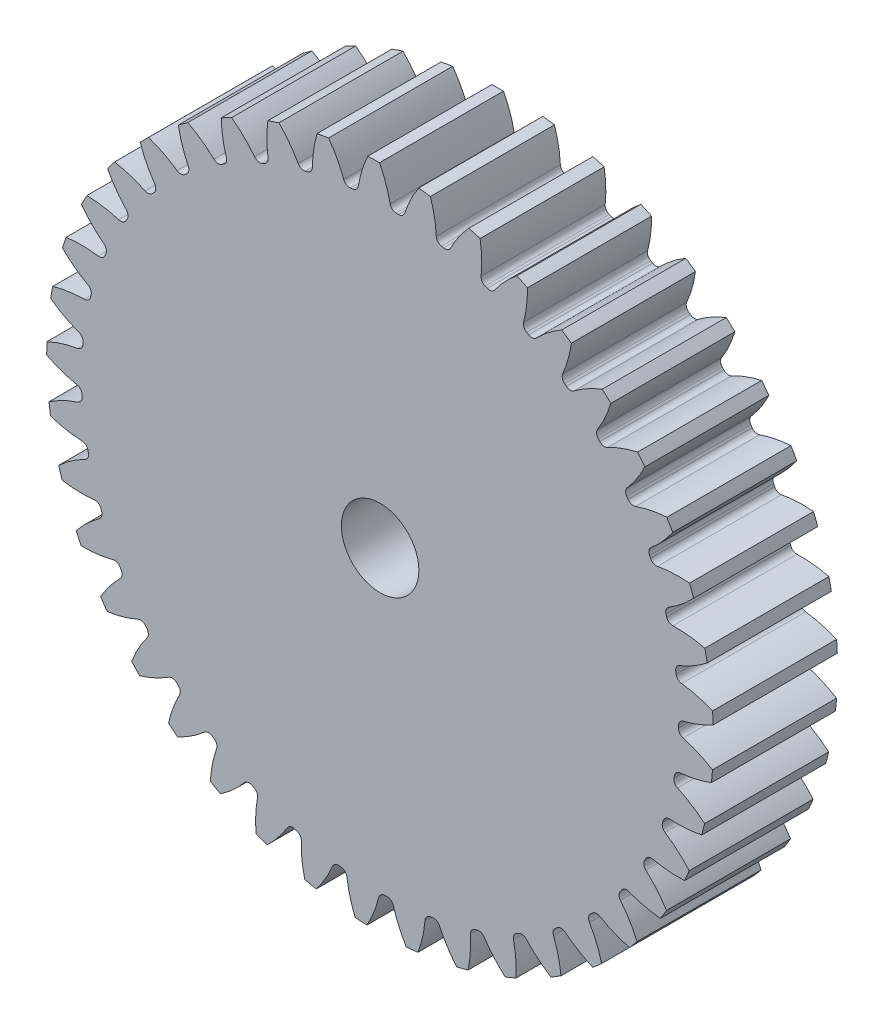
SolidWorks part; units mm, degrees
ref_plane "Front" through (0, 0, 0) normal (0, 0, 1) x (1, 0, 0)
ref_plane "Top" through (0, 0, 0) normal (0, 1, 0) x (1, 0, 0)
ref_plane "Right" through (0, 0, 0) normal (1, 0, 0) x (0, 0, -1)
sketch "Sketch3" plane through (0, 0, 0) normal (0, 0, 1) x (1, 0, 0)
  circle A0 centre (0, 0) radius 273.05
  dimension "od" = 546.1
extrude "gearBody" add sketch "Sketch3" along normal blind 101.6
sketch "Sketch2" plane through (0, 0, 0) normal (0, 0, 1) x (1, 0, 0)
  line L0 (0, 0) -> (226.0262, 93.6231) construction
  line L1 (272.4391, -21.3623) -> (0, 0) construction
  line L2 (0, 0) -> (36.3143, 0) construction
  line L3 (260.3013, 5.0374) -> (259.9273, -14.8297) construction
  line L5 (260.1143, -4.8962) -> (0, 0) construction
  line L7 (0, 0) -> (244.649, 0) construction
  arc A0 (244.6485, 0.4812) -> (244.4571, -9.6877) centre (0, 0) ccw construction
  arc A1 (272.8296, 10.9693) -> (272.2235, -21.2289) centre (0, 0) ccw construction
  arc A2 (260.3013, 5.0374) -> (259.9273, -14.8297) centre (0, 0) ccw construction
  arc A3 (244.4116, -5.5655) -> (244.448, -3.6364) centre (0, 0) ccw
  arc A4 (272.4391, -21.3623) -> (248.1735, -10.6573) centre (222.3428, -102.0628) ccw
  arc A5 (272.4391, -21.3623) -> (273.05, 11.0945) centre (0, 0) ccw
  arc A6 (273.05, 11.0945) -> (248.3988, 1.3102) centre (226.0262, 93.6231) cw
  arc A7 (244.448, -3.6364) -> (248.3988, 1.3102) centre (249.6163, -3.7133) cw
  arc A8 (248.1735, -10.6573) -> (244.4116, -5.5655) centre (249.5792, -5.6832) cw
  point P6 (273.05, 11.0945)
  point P22 (272.4391, -21.3623)
  dimension "baseDia" = 489.2979
  dimension "od" = 546.1
  dimension "pd" = 520.7
  dimension "rd" = 488.95
  dimension "rFillet" = 5.1689
  dimension "pointX" = 273.05
  dimension "pointY" = 11.0945
  dimension "CTT" = 19.8672
  dimension "flankCenterAngle" = 22.5
extrude "toothCut" cut sketch "Sketch2" along normal through all
pattern_circular "CirPattern1" count 41 over 360 about axis through (0, 0, 0) along (0, 0, 1) of "toothCut"
sketch "hub1Dia" plane through (0, 0, 0) normal (0, 0, -1) x (-1, 0, 0)
  circle A0 centre (0, 0) radius 12.7
  dimension "hub1Dia" = 25.4
sketch "hub2Dia" plane through (0, 0, 101.6) normal (0, 0, 1) x (1, 0, 0)
  circle A0 centre (0, 0) radius 12.7
  dimension "hub2dia" = 25.4
sketch "boreDia" plane through (0, 0, 0) normal (0, 0, 1) x (1, 0, 0)
  circle A0 centre (0, 0) radius 31.75
  dimension "boreDia" = 63.5
extrude "bore" cut sketch "boreDia" against normal mid plane 25400
